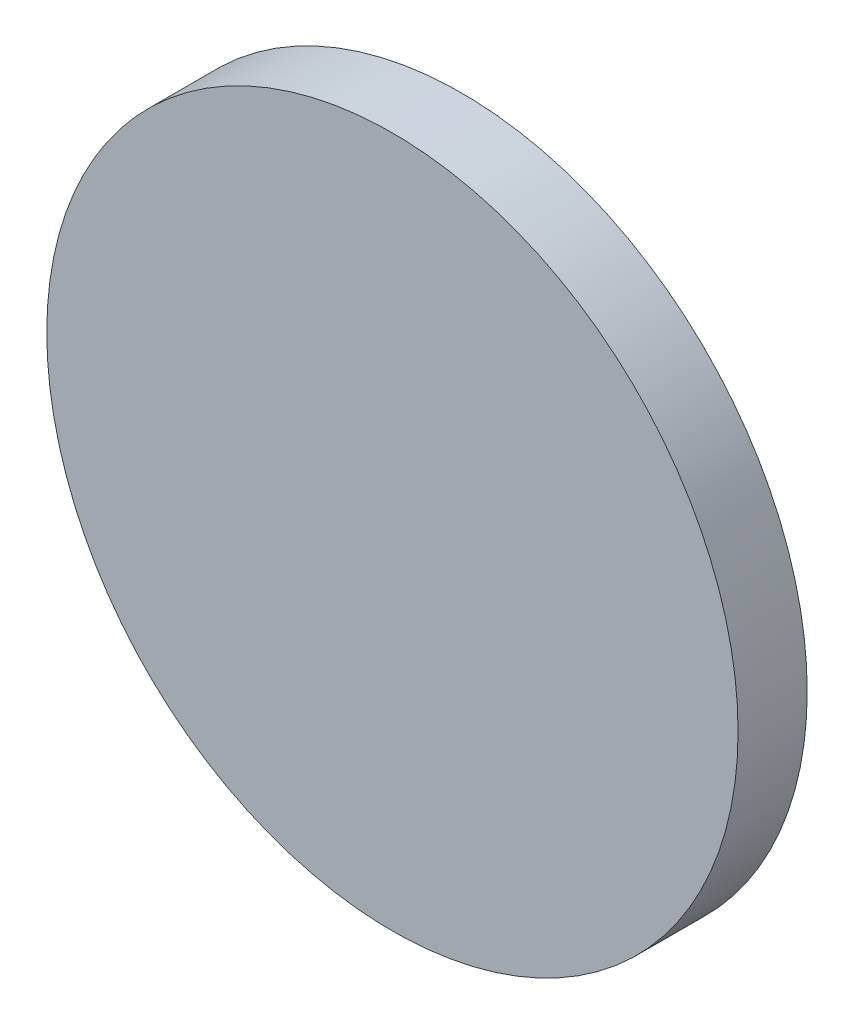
SolidWorks part; units mm, degrees
ref_plane "Plan de face" through (0, 0, 0) normal (0, 0, 1) x (1, 0, 0)
ref_plane "Plan de dessus" through (0, 0, 0) normal (0, 1, 0) x (1, 0, 0)
ref_plane "Plan de droite" through (0, 0, 0) normal (1, 0, 0) x (0, 0, -1)
sketch "Esquisse1" plane through (0, 0, 0) normal (0, 0, 1) x (1, 0, 0)
  circle A0 centre (0, 0) radius 50
  dimension "D1" = 100
extrude "Boss.-Extru.1" add sketch "Esquisse1" along normal blind 10
sketch "Esquisse2" [suppressed] plane through (0, 0, 10) normal (0, 0, 1) x (1, 0, 0)
  circle A0 centre (-18.6242, 22.9538) radius 10.4299
extrude "Enlèv. mat.-Extru.1" [suppressed] cut sketch "Esquisse2" against normal through all
sketch "Esquisse3" [suppressed] plane through (0, 0, 10) normal (0, 0, 1) x (1, 0, 0)
  circle A0 centre (6.4688, -16.2573) radius 10.7886
extrude "Enlèv. mat.-Extru.2" [suppressed] cut sketch "Esquisse3" against normal through all
